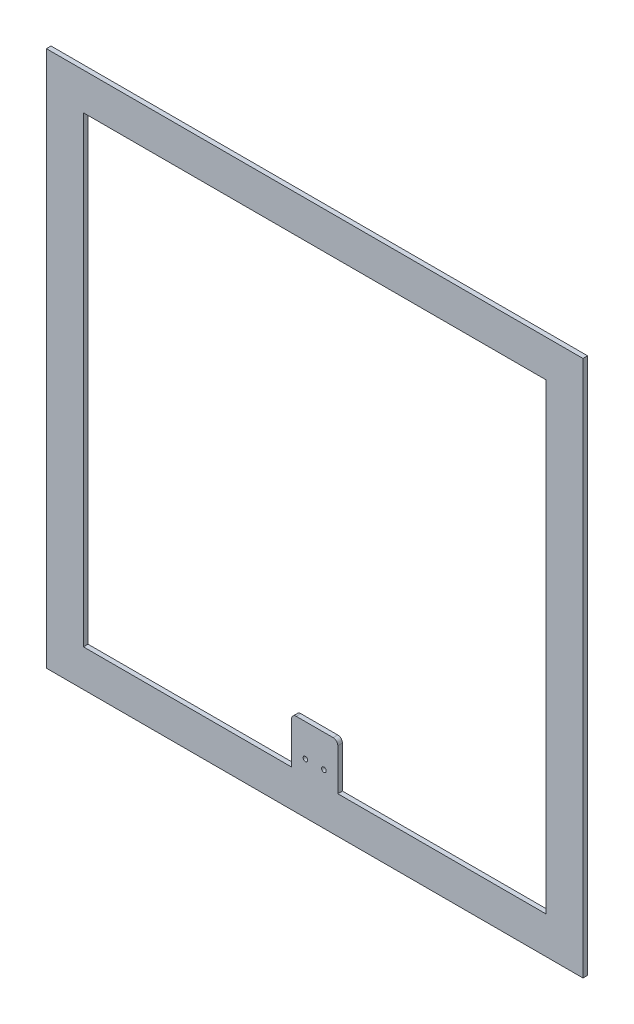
SolidWorks part; units mm, degrees
ref_plane "Front" through (0, 0, 0) normal (0, 0, 1) x (1, 0, 0)
ref_plane "Top" through (0, 0, 0) normal (0, 1, 0) x (1, 0, 0)
ref_plane "Right" through (0, 0, 0) normal (1, 0, 0) x (0, 0, -1)
sketch "Esquisse1" plane through (0, 0, 0) normal (0, 0, 1) x (1, 0, 0)
  line L0 (0, 0) -> (0, -290) construction
  line L1 (-250, 250) -> (250, 250)
  line L2 (-250, 250) -> (-250, -250)
  line L3 (-250, -250) -> (-25, -250)
  line L4 (250, 250) -> (250, -250)
  line L5 (-250, 250) -> (250, -250) construction
  line L6 (-250, -250) -> (250, 250) construction
  line L7 (-290, 290) -> (290, 290)
  line L8 (-290, 290) -> (-290, -290)
  line L9 (-290, -290) -> (290, -290)
  line L10 (290, 290) -> (290, -290)
  line L11 (-290, 290) -> (290, -290) construction
  line L12 (-290, -290) -> (290, 290) construction
  line L13 (25, -250) -> (250, -250)
  line L15 (-25, -250) -> (-25, -200)
  line L16 (-25, -200) -> (25, -200)
  line L17 (25, -250) -> (25, -200)
  point P0 (0, 0)
  point P6 (0, 0)
  dimension "D1" = 500
  dimension "D2" = 500
  dimension "D3" = 40
  dimension "D4" = 40
  dimension "D5" = 50
  dimension "D6" = 25
  dimension "D7" = 50
extrude "Boss.-Extru.1" add sketch "Esquisse1" along normal blind 5
sketch "Esquisse2" plane through (0, 0, 5) normal (0, 0, 1) x (1, 0, 0)
  line L0 (0, -290) -> (0, -200) construction
  line L1 (-290, -290) -> (290, -290) construction
  line L3 (0, -235) -> (-10, -235) construction
  line L4 (-25, -200) -> (25, -200) construction
  line L5 (-250, -250) -> (-25, -250) construction
  circle A0 centre (-10, -235) radius 2.5
  circle A1 centre (10, -235) radius 2.5
  point P4 (-8.3766, -227.1413)
  dimension "D2" = 5
  dimension "D1" = 10
  dimension "D3" = 15
extrude "Enlèv. mat.-Extru.1" cut sketch "Esquisse2" against normal up to next
fillet "Congé1" radius 5 2 edges at (25, -200, 2.5) (-25, -200, 2.5)
